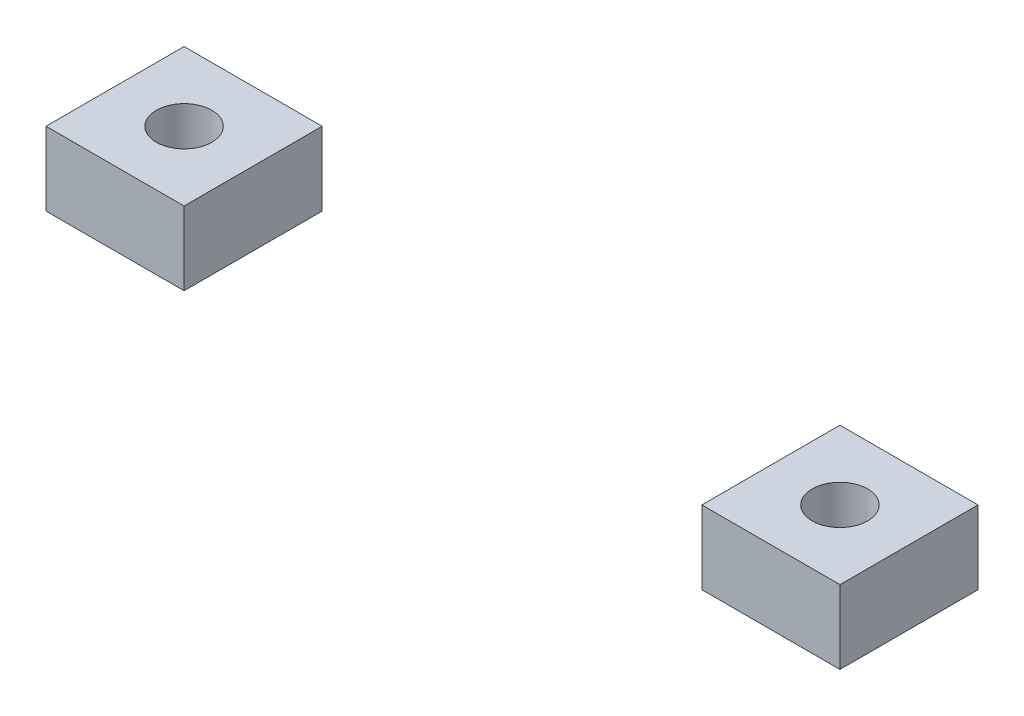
SolidWorks part; units mm, degrees
ref_plane "Front" through (0, 0, 0) normal (0, 0, 1) x (1, 0, 0)
ref_plane "Top" through (0, 0, 0) normal (0, 1, 0) x (1, 0, 0)
ref_plane "Right" through (0, 0, 0) normal (1, 0, 0) x (0, 0, -1)
sketch "Sketch1" plane through (0, 0, 0) normal (0, 1, 0) x (1, 0, 0)
  line L0 (0, 0) -> (-30.1625, 0) construction
  line L1 (-36.5125, 6.35) -> (-36.5125, -6.35)
  line L2 (-36.5125, -6.35) -> (-23.8125, -6.35)
  line L3 (-23.8125, -6.35) -> (-23.8125, 6.35)
  line L4 (-23.8125, 6.35) -> (-36.5125, 6.35)
  line L5 (23.8125, 6.35) -> (23.8125, -6.35)
  line L6 (23.8125, -6.35) -> (36.5125, -6.35)
  line L7 (36.5125, -6.35) -> (36.5125, 6.35)
  line L8 (36.5125, 6.35) -> (23.8125, 6.35)
  line L9 (0, 0) -> (0, 11.1624) construction
  circle A0 centre (-30.1625, 0) radius 6.35 construction
  circle A1 centre (30.1625, 0) radius 6.35 construction
  circle A2 centre (-30.1625, 0) radius 2.5527
  circle A3 centre (30.1625, 0) radius 2.5527
  dimension "D1" = 5.1054
  dimension "D2" = 60.325
  dimension "D3" = 12.7
extrude "Boss-Extrude1" add sketch "Sketch1" along normal blind 6.7564
